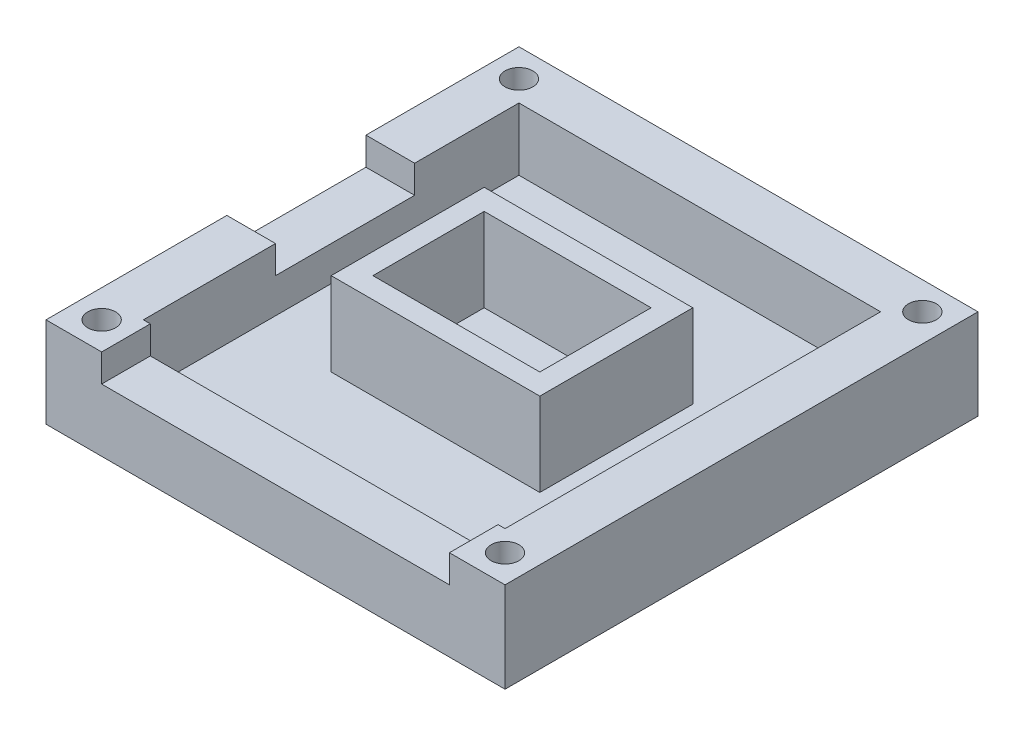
SolidWorks part; units mm, degrees
ref_plane "Alzado" through (0, 0, 0) normal (0, 0, 1) x (1, 0, 0)
ref_plane "Planta" through (0, 0, 0) normal (0, 1, 0) x (1, 0, 0)
ref_plane "Vista lateral" through (0, 0, 0) normal (1, 0, 0) x (0, 0, -1)
sketch "Sketch1" plane through (0, 0, 0) normal (0, 0, 1) x (1, 0, 0)
  line L5 (7.75, 2.1) -> (9.75, 2.1)
  line L6 (-9.75, 2.1) -> (-7.75, 2.1)
  line L11 (-9.75, 2.1) -> (-9.75, 0)
  line L12 (-9.75, 0) -> (9.75, 0)
  line L18 (9.75, 2.1) -> (9.75, 0)
  line L19 (-9.75, 2.1) -> (9.75, 0) construction
  line L20 (-9.75, 0) -> (9.75, 2.1) construction
  line L22 (-7.75, 4) -> (-7.75, 2.1)
  line L24 (7.75, 4) -> (7.75, 2.1)
  line L25 (-7.75, 4) -> (7.75, 2.1) construction
  line L26 (-7.75, 2.1) -> (7.75, 4) construction
  line L27 (7.75, 4) -> (16.5, 4)
  line L28 (-16.5, 10.5) -> (16.5, 10.5)
  line L29 (-16.5, 10.5) -> (-16.5, 4)
  line L30 (-16.5, 4) -> (-7.75, 4)
  line L31 (16.5, 10.5) -> (16.5, 4)
  line L32 (-16.5, 10.5) -> (16.5, 4) construction
  line L33 (-16.5, 4) -> (16.5, 10.5) construction
  point P0 (0, 1.05)
  point P7 (0, 3.05)
  point P12 (0, 7.25)
extrude "Boss-Extrude1" add sketch "Sketch1" along normal blind 20 contours L28 L31 L27 L24 L5 L18 L12 L11 L6 L22 L30 L29
sketch "Sketch2" plane through (0, 0, 20) normal (0, 0, 1) x (1, 0, 0)
  line L1 (-16.5, 4) -> (16.5, 4)
  line L2 (-16.5, 4) -> (-16.5, 10.5)
  line L3 (-16.5, 10.5) -> (16.5, 10.5)
  line L4 (16.5, 4) -> (16.5, 10.5)
  line L5 (-16.5, 4) -> (16.5, 10.5) construction
  line L6 (-16.5, 10.5) -> (16.5, 4) construction
  point P0 (0, 7.25)
extrude "Boss-Extrude2" add sketch "Sketch2" along normal blind 7
sketch "Sketch3" plane through (0, 0, 0) normal (0, 0, -1) x (-1, 0, 0)
  line L1 (-16.5, 4) -> (16.5, 4)
  line L2 (-16.5, 4) -> (-16.5, 10.5)
  line L3 (-16.5, 10.5) -> (16.5, 10.5)
  line L4 (16.5, 4) -> (16.5, 10.5)
  line L5 (-16.5, 4) -> (16.5, 10.5) construction
  line L6 (-16.5, 10.5) -> (16.5, 4) construction
  point P0 (0, 7.25)
extrude "Boss-Extrude3" add sketch "Sketch3" along normal blind 7
sketch "Sketch4" plane through (0, 10.5, 0) normal (0, 1, 0) x (1, 0, 0)
  line L0 (16.5, -27) -> (16.5, 7) construction
  line L1 (-13, -23.5) -> (13, -23.5)
  line L2 (-13, -23.5) -> (-13, 3.5)
  line L3 (-13, 3.5) -> (13, 3.5)
  line L4 (13, -23.5) -> (13, 3.5)
  line L5 (-13, -23.5) -> (13, 3.5) construction
  line L6 (-13, 3.5) -> (13, -23.5) construction
  point P0 (0, -10)
  point P8 (16.5, -10)
extrude "Cut-Extrude1" cut sketch "Sketch4" against normal blind 4.5
sketch "Sketch5" plane through (0, 0, 27) normal (0, 0, 1) x (1, 0, 0)
  line L0 (16.5, 10.5) -> (-16.5, 10.5) construction
  line L1 (-12.5, 12.5) -> (12.5, 12.5)
  line L2 (-12.5, 12.5) -> (-12.5, 8.5)
  line L3 (-12.5, 8.5) -> (12.5, 8.5)
  line L4 (12.5, 12.5) -> (12.5, 8.5)
  line L5 (-12.5, 12.5) -> (12.5, 8.5) construction
  line L6 (-12.5, 8.5) -> (12.5, 12.5) construction
  point P0 (0, 10.5)
  dimension "D1" = 4
  dimension "D2" = 25
extrude "Cut-Extrude2" cut sketch "Sketch5" against normal blind 14
sketch "Sketch6" plane through (-16.5, 0, 0) normal (-1, 0, 0) x (0, 0, 1)
  line L0 (27, 10.5) -> (-7, 10.5) construction
  line L1 (4, 8.5) -> (14, 8.5)
  line L2 (4, 8.5) -> (4, 12.5)
  line L3 (4, 12.5) -> (14, 12.5)
  line L4 (14, 8.5) -> (14, 12.5)
  line L5 (4, 8.5) -> (14, 12.5) construction
  line L6 (4, 12.5) -> (14, 8.5) construction
  line L7 (-7, 4) -> (-7, 10.5) construction
  point P0 (9, 10.5)
  dimension "D1" = 4
  dimension "D2" = 10
  dimension "D3" = 11
extrude "Cut-Extrude3" cut sketch "Sketch6" against normal blind 8
sketch "Sketch7" plane through (0, 10.5, 0) normal (0, 1, 0) x (1, 0, 0)
  line L0 (0, 6.784) -> (0, -12.6238) construction
  line L1 (-16.5, 7) -> (16.5, 7) construction
  line L2 (-16.5, -4) -> (-16.5, 7) construction
  line L3 (-6.1702, -10) -> (9.2981, -10) construction
  line L4 (16.5, -27) -> (16.5, 7) construction
  circle A0 centre (-14.5, 5) radius 1
  circle A1 centre (14.5, 5) radius 1
  circle A2 centre (14.5, -25) radius 1
  circle A3 centre (-14.5, -25) radius 1
  point P15 (16.5, -10)
  dimension "D1" = 2
  dimension "D2" = 2
  dimension "D3" = 2
extrude "Cut-Extrude4" cut sketch "Sketch7" against normal blind 3
sketch "Sketch8" plane through (0, 6, 0) normal (0, 1, 0) x (1, 0, 0)
  line L0 (13, -23.5) -> (13, 3.5) construction
  line L1 (-6, -6) -> (6, -6)
  line L2 (-6, -6) -> (-6, -14)
  line L3 (-6, -14) -> (6, -14)
  line L4 (6, -6) -> (6, -14)
  line L5 (-6, -6) -> (6, -14) construction
  line L6 (-6, -14) -> (6, -6) construction
  line L8 (-7.5, -15.5) -> (7.5, -15.5)
  line L9 (-7.5, -15.5) -> (-7.5, -4.5)
  line L10 (-7.5, -4.5) -> (7.5, -4.5)
  line L11 (7.5, -15.5) -> (7.5, -4.5)
  line L12 (-7.5, -15.5) -> (7.5, -4.5) construction
  line L13 (-7.5, -4.5) -> (7.5, -15.5) construction
  point P0 (0, -10)
  point P7 (13, -10)
  point P10 (0, -10)
  dimension "D1" = 8
  dimension "D2" = 12
  dimension "D3" = 1.5
  dimension "D4" = 1.5
extrude "Boss-Extrude4" add sketch "Sketch8" along normal blind 6
equation "\"alto\"= 6.5"
equation "\"ancho\"= 33"
equation "\"placa_ancho\"= 26"
equation "\"placa_largo\"= 27"
equation "\"largo\"= 7"
equation "\"D5@Sketch1\"=\"ancho\""
equation "\"D6@Sketch1\"=\"alto\""
equation "\"D1@Boss-Extrude2\"=\"largo\""
equation "\"D1@Boss-Extrude3\"=\"largo\""
equation "\"D2@Sketch4\"=\"placa_largo\""
equation "\"D1@Cut-Extrude1\"=\"alto\"-2"
equation "\"D1@Sketch4\"=\"placa_ancho\""
